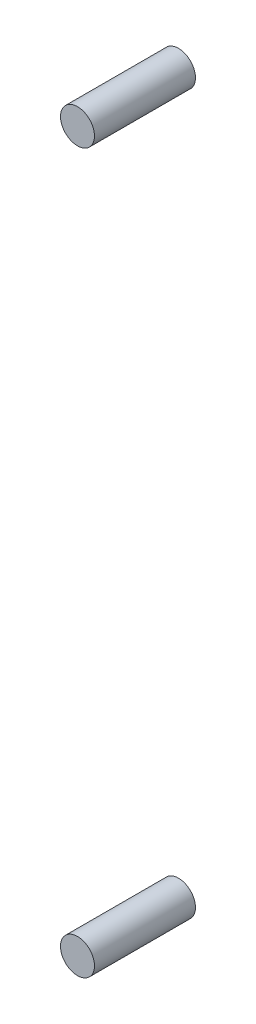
SolidWorks part; units mm, degrees
ref_plane "Plan de face" through (0, 0, 0) normal (0, 0, 1) x (1, 0, 0)
ref_plane "Plan de dessus" through (0, 0, 0) normal (0, 1, 0) x (1, 0, 0)
ref_plane "Plan de droite" through (0, 0, 0) normal (1, 0, 0) x (0, 0, -1)
sketch "Esquisse1" plane through (0, 0, 0) normal (0, 0, 1) x (1, 0, 0)
  circle A0 centre (25, 831.5) radius 17.5
  arc A1 (41.0512, 838.4719) -> (41.0512, 824.5281) centre (25, 831.5) ccw construction
  circle A2 centre (25, 91.5) radius 17.5
  arc A3 (41.0512, 98.4719) -> (41.0512, 84.5281) centre (25, 91.5) ccw construction
extrude "Boss.-Extru.1" add sketch "Esquisse1" against normal up to surface (104 mm away)
